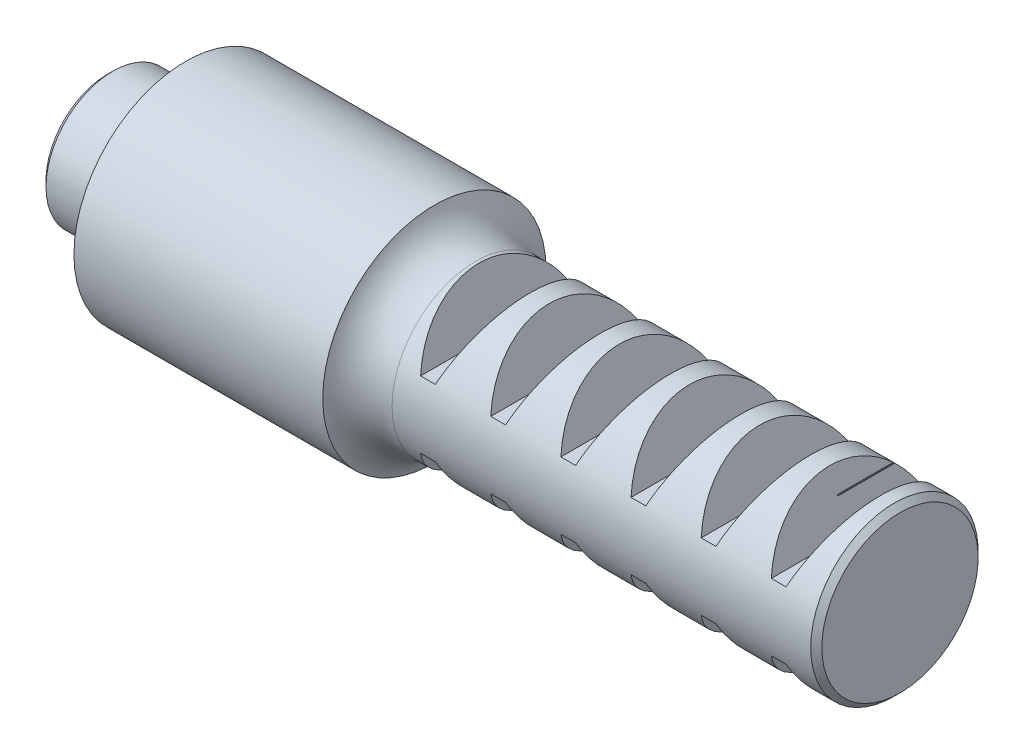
SolidWorks part; units mm, degrees
ref_plane "Plan1" through (0, 0, 0) normal (0, 0, 1) x (1, 0, 0)
ref_plane "Plan2" through (0, 0, 0) normal (0, 1, 0) x (1, 0, 0)
ref_plane "Plan3" through (0, 0, 0) normal (1, 0, 0) x (0, 0, -1)
sketch "Esquisse1" plane through (0, 0, 0) normal (0, 0, 1) x (1, 0, 0)
  line L0 (0, 0) -> (86, 0) construction
  line L1 (-7, 0) -> (-7, 6)
  line L2 (0, 10) -> (0, 6)
  line L3 (0, 6) -> (-7, 6)
  line L7 (0, 10) -> (22.2919, 10)
  line L9 (26, 7.5) -> (64, 7.5)
  line L10 (64, 7.5) -> (64, 0)
  line L11 (64, 0) -> (-7, 0)
  line L15 (34, 5.5) -> (54, 5.5) construction
  arc A0 (26, 7.5) -> (22.2919, 10) centre (26, 11.5) cw
  dimension "D6" = 4
  dimension "D1" = 15
  dimension "D2" = 20
  dimension "D3" = 26
  dimension "D4" = 64
  dimension "D5" = 7
  dimension "D7" = 12
  dimension "D10" = 5.5
revolve "BASE" add sketch "Esquisse1" angle 360 about L0
chamfer "Chanfrein1" distance 0.5 angle 45
sketch "Esquisse2" plane through (0, 0, 0) normal (0, 0, 1) x (1, 0, 0)
  line L0 (0, 0) -> (69, 0) construction
  line L1 (0, 0) -> (86, 0) construction
  line L2 (30.8894, 7.5) -> (26.2919, 7.5)
  line L3 (27.9298, 3) -> (29.2515, 3)
  line L4 (29.2515, 3) -> (30.8894, 7.5)
  line L5 (22.2919, 10) -> (22.2919, -10) construction
  line L8 (63.5, 7.5) -> (26, 7.5) construction
  line L9 (27.9298, 3) -> (26.2919, 7.5)
  line L10 (27.0198, 5.5) -> (33.303, 5.5) construction
  point P16 (30.1614, 5.5)
  dimension "D1" = 70
  dimension "D2" = 2.5
  dimension "D3" = 2
  dimension "D4" = 6.2832
  dimension "D5" = 4
  dimension "D6" = 70
extrude "CREUX" cut sketch "Esquisse2" against normal through all and the other way through all
pattern_linear "Répétition linéaire1" count 6 spacing 6.2832 along (1, 0, 0)
mirror "Symétrie1" about plane through (0, 0, 0) normal (0, 1, 0)
chamfer "Chanfrein2" distance 0.5 angle 45
hole_wizard "Trou taraudé M6x1.01" positions "Esquisse4" profile "Esquisse3" tap size "M6x1.0" standard "ISO"
sketch "Esquisse4" plane through (-7, 0, 0) normal (-1, 0, 0) x (0, 0, 1)
  point P0 (0, 0)
sketch "Esquisse3" plane through (-7, 0, 0) normal (0, 1, 0) x (0, 0, 1)
  line L0 (0, 0) -> (0, 16.4434)
  line L1 (0, 16.4434) -> (2.5, 15)
  line L2 (2.5, 15) -> (2.5, 0)
  line L5 (2.5, 0) -> (0, 0)
  line L10 (0, 16.4434) -> (-2.5, 15) construction
  line L11 (0, -6.35) -> (0, 107.95) construction
  dimension "Diamètre du perçage" = 5
  dimension "Profondeur du perçage" = 15
  dimension "Angle de pointe" = 120
sketch "Esquisse5" plane through (0, 0, 0) normal (0, 0, 1) x (1, 0, 0)
  line L0 (58.4, 5.5) -> (58.4358, 5.5)
  line L1 (59.3457, 3) -> (60.6674, 3) construction
  line L3 (58.4, 5.5983) -> (58.4, 5.5)
  line L4 (64, -7) -> (64, 7) construction
  line L7 (58.4, 5.5983) -> (58.4358, 5.5)
  line L8 (59.3457, 3) -> (57.7078, 7.5) construction
  point P2 (60.0066, 3)
  dimension "D1" = 2.5
  dimension "D2" = 5.6
extrude "Enlèv. mat.-Extru.1" cut sketch "Esquisse5" against normal through all
mirror "Symétrie2" about plane through (0, 0, 0) normal (0, 1, 0) of "Enlèv. mat.-Extru.1"
